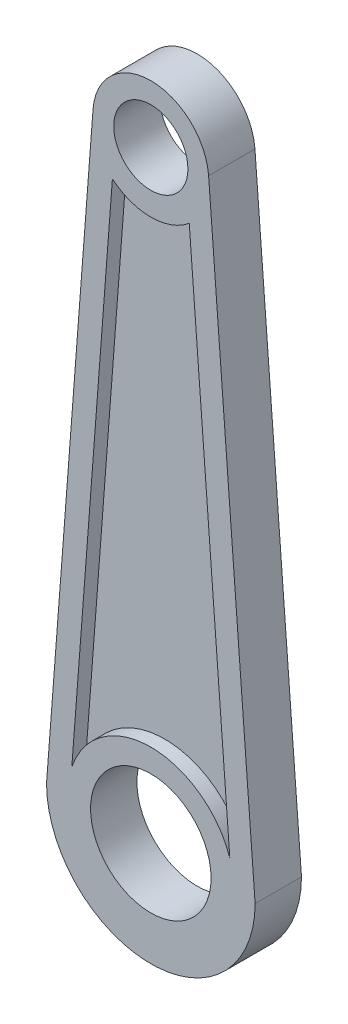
SolidWorks part; units mm, degrees
ref_plane "Front Plane" through (0, 0, 0) normal (0, 0, 1) x (1, 0, 0)
ref_plane "Top Plane" through (0, 0, 0) normal (0, 1, 0) x (1, 0, 0)
ref_plane "Right Plane" through (0, 0, 0) normal (1, 0, 0) x (0, 0, -1)
sketch "Sketch1" plane through (0, 0, 0) normal (0, 0, 1) x (1, 0, 0)
  line L0 (-22.5, 0) -> (-12.4634, 130.9552)
  line L1 (12.4634, 130.9552) -> (22.5, 0)
  circle A0 centre (0, 0) radius 22.5
  circle A1 centre (0, 0) radius 13
  circle A2 centre (0, 130) radius 12.5
  circle A3 centre (0, 130) radius 8
  dimension "D2" = 25
  dimension "D3" = 45
  dimension "D4" = 16
  dimension "D5" = 26
  dimension "D1" = 130
extrude "Boss-Extrude1" add sketch "Sketch1" along normal blind 10 contours A2 L0 A0 L1 | L1 A0 L0 A1 | A2 A3
sketch "Sketch2" plane through (0, 0, 10) normal (0, 0, 1) x (1, 0, 0)
  line L4 (17.4991, -0.1793) -> (7.4781, 130.5731)
  line L5 (-7.4781, 130.5731) -> (-17.4991, -0.1793)
  line L6 (17.0411, 5.7967) -> (8.2895, 119.9858)
  line L7 (-8.2895, 119.9858) -> (-17.0411, 5.7967)
  arc A4 (7.4781, 130.5731) -> (-7.4781, 130.5731) centre (0, 130) ccw
  arc A5 (-17.4991, -0.1793) -> (17.4991, -0.1793) centre (0, 0) ccw
  circle A8 centre (0, 130) radius 13
  arc A9 (-8.2895, 119.9858) -> (8.2895, 119.9858) centre (0, 130) ccw
  circle A11 centre (0, 0) radius 18
  arc A12 (17.0411, 5.7967) -> (-17.0411, 5.7967) centre (0, 0) ccw
  dimension "D1" = 5
  dimension "D2" = 5
  dimension "D3" = 5
extrude "Cut-Extrude1" cut sketch "Sketch2" against normal blind 3
ref_plane "Plane2" through (0, 0, 5) normal (0, 0, 1) x (1, 0, 0)
mirror "Mirror2" about plane through (0, 0, 5) normal (0, 0, 1) of "Cut-Extrude1"
